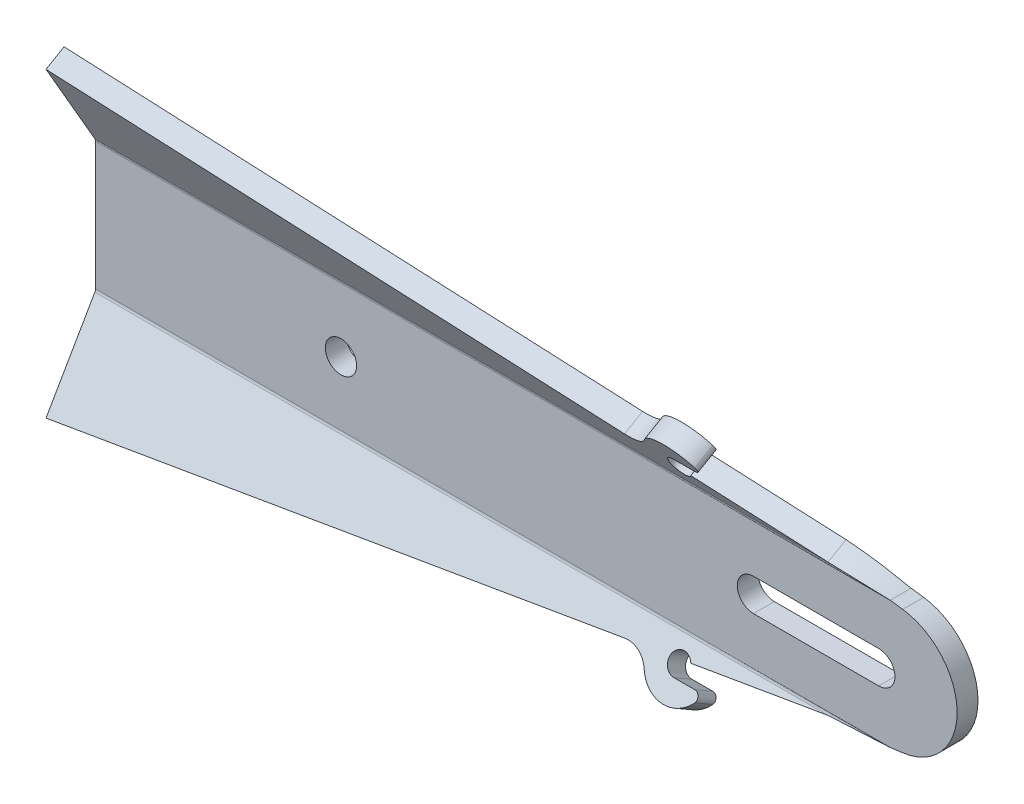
SolidWorks part; units mm, degrees
ref_plane "Plan de face" through (0, 0, 0) normal (0, 0, 1) x (1, 0, 0)
ref_plane "Plan de dessus" through (0, 0, 0) normal (0, 1, 0) x (1, 0, 0)
ref_plane "Plan de droite" through (0, 0, 0) normal (1, 0, 0) x (0, 0, -1)
sketch "Esquisse1" plane through (0, 0, 0) normal (0, 0, 1) x (1, 0, 0)
  line L0 (-150, 67.9736) -> (-150, -94.3342) construction
  line L1 (-175, 67.9736) -> (-175, -94.3342) construction
  circle A0 centre (-162.5, -34) radius 8 construction
  circle A1 centre (-103, 0) radius 3 construction
  circle A2 centre (-24, 0) radius 3.1 construction
  circle A3 centre (0, 0) radius 3.1 construction
  circle A4 centre (-162.5, 34) radius 8 construction
  dimension "D2" = 16
  dimension "D3" = 12.5
  dimension "D4" = 34
  dimension "D5" = 47
  dimension "D6" = 150
  dimension "D7" = 24
  dimension "D8" = 6.2
  dimension "D9" = 6
  dimension "D10" = 34
  dimension "D1" = 25
sketch "Esquisse2" plane through (0, 0, 0) normal (0, 0, 1) x (1, 0, 0)
  line L0 (-150, 32.5) -> (-46.1225, 18.6538)
  line L1 (-36, 39.7071) -> (-36, -36.0023) construction
  line L2 (-150, 67.9736) -> (-150, -94.3342) construction
  line L3 (-32, 20) -> (-36, 20)
  line L4 (4.5855, -11.8948) -> (-34.2301, -17.0687)
  line L5 (-150, -32.5) -> (-150, 32.5)
  line L6 (-24, 3.1) -> (0, 3.1)
  line L7 (-24, -3.1) -> (0, -3.1)
  line L8 (-32, -20) -> (-36, -20)
  line L9 (-16.4108, 0) -> (57.4228, 0) construction
  line L12 (-34.2301, 17.0687) -> (4.5855, 11.8948)
  line L19 (-46.1225, -18.6538) -> (-150, -32.5)
  arc A0 (4.5855, -11.8948) -> (4.5855, 11.8948) centre (3, 0) ccw
  circle A1 centre (0, 0) radius 3.1 construction
  circle A2 centre (-24, 0) radius 3.1 construction
  circle A3 centre (-103, 0) radius 3 construction
  arc A4 (0, -3.1) -> (0, 3.1) centre (0, 0) ccw
  arc A5 (-24, 3.1) -> (-24, -3.1) centre (-24, 0) ccw
  circle A6 centre (-103, 0) radius 3
  arc A7 (-46.1225, 18.6538) -> (-41.161, 21.06) centre (-45.4619, 23.61) ccw
  arc A8 (-41.161, 21.06) -> (-31.2, 21.6) centre (-36, 18) cw
  arc A9 (-31.2, 21.6) -> (-32, 20) centre (-32, 21) cw
  arc A10 (-36, 20) -> (-34.2301, 17.0687) centre (-36, 18) ccw
  arc A11 (-36, -20) -> (-34.2301, -17.0687) centre (-36, -18) cw
  arc A12 (-31.2, -21.6) -> (-32, -20) centre (-32, -21) ccw
  arc A13 (-41.161, -21.06) -> (-31.2, -21.6) centre (-36, -18) ccw
  arc A14 (-46.1225, -18.6538) -> (-41.161, -21.06) centre (-45.4619, -23.61) cw
  point P24 (-150, 0)
  dimension "D5" = 3
  dimension "D1" = 12
  dimension "D6" = 5
  dimension "D7" = 2
  dimension "D8" = 1
  dimension "D9" = 20
  dimension "D4" = 6
  dimension "D2" = 114
  dimension "D3" = 65
extrude "Extrusion1" add sketch "Esquisse2" along normal blind 4
sheet metal parameters "Tôlerie 1" parameters "D1"=1
flatten bends "Dépliage 1" parameters "D1"=1
sketch "Esquisse-Angle1" plane through (0, 0, 4) normal (0, 0, 1) x (1, 0, 0)
process bends "Pliage 1" parameters "D1"=0.7366
sketch "Esquisse-Plate1" plane through (0, 0, 4) normal (0, 0, 1) x (1, 0, 0)
  line L0 (-150, 13) -> (88.5025, 13)
  line L1 (-150, 67.9736) -> (-150, -94.3342) construction
  line L2 (-150, -13) -> (88.5025, -13)
  line L3 (0, 0) -> (-168.8653, 0) construction
  point P3 (-76.853, 0)
  dimension "D1" = 26
bend "Pli défini à plat1" bend radius 0.7366 bend angle 30 parameters "D5"=1
bend "Pli défini à plat2" bend radius 0.7366 bend angle 30 parameters "D5"=2
